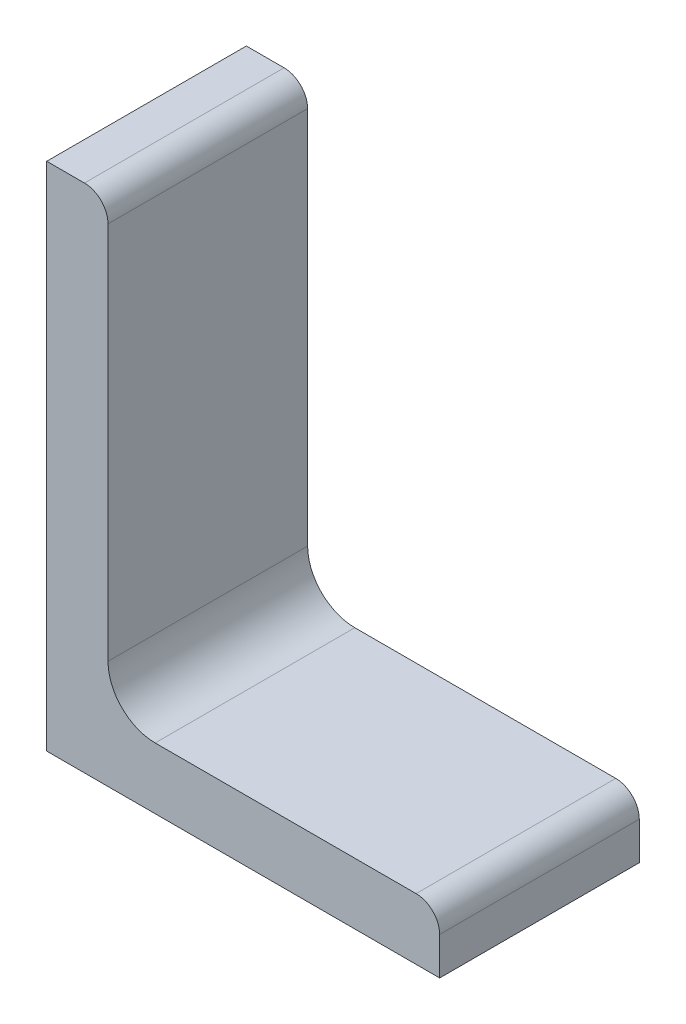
SolidWorks part; units mm, degrees
ref_plane "Front Plane" through (0, 0, 0) normal (0, 0, 1) x (1, 0, 0)
ref_plane "Top Plane" through (0, 0, 0) normal (0, 1, 0) x (1, 0, 0)
ref_plane "Right Plane" through (0, 0, 0) normal (1, 0, 0) x (0, 0, -1)
other "Configuration Table"
sketch "Sketch1" plane through (0, 0, 0) normal (0, 0, 1) x (1, 0, 0)
  line L1 (0, 0) -> (50, 0)
  line L2 (0, 0) -> (0, 65)
  line L3 (0, 65) -> (4.8, 65)
  line L4 (50, 0) -> (50, 4.8)
  line L6 (7.8, 62) -> (7.8, 13.8)
  line L7 (13.8, 7.8) -> (47, 7.8)
  arc A0 (7.8, 13.8) -> (13.8, 7.8) centre (13.8, 13.8) ccw
  arc A1 (4.8, 65) -> (7.8, 62) centre (4.8, 62) cw
  arc A2 (50, 4.8) -> (47, 7.8) centre (47, 4.8) ccw
  dimension "Radius_root" = 6
  dimension "Radius_toe" = 3
  dimension "Width" = 50
  dimension "Thickness" = 7.8
  dimension "Depth" = 65
extrude "BaseSection" add sketch "Sketch1" along normal mid plane 25.4
